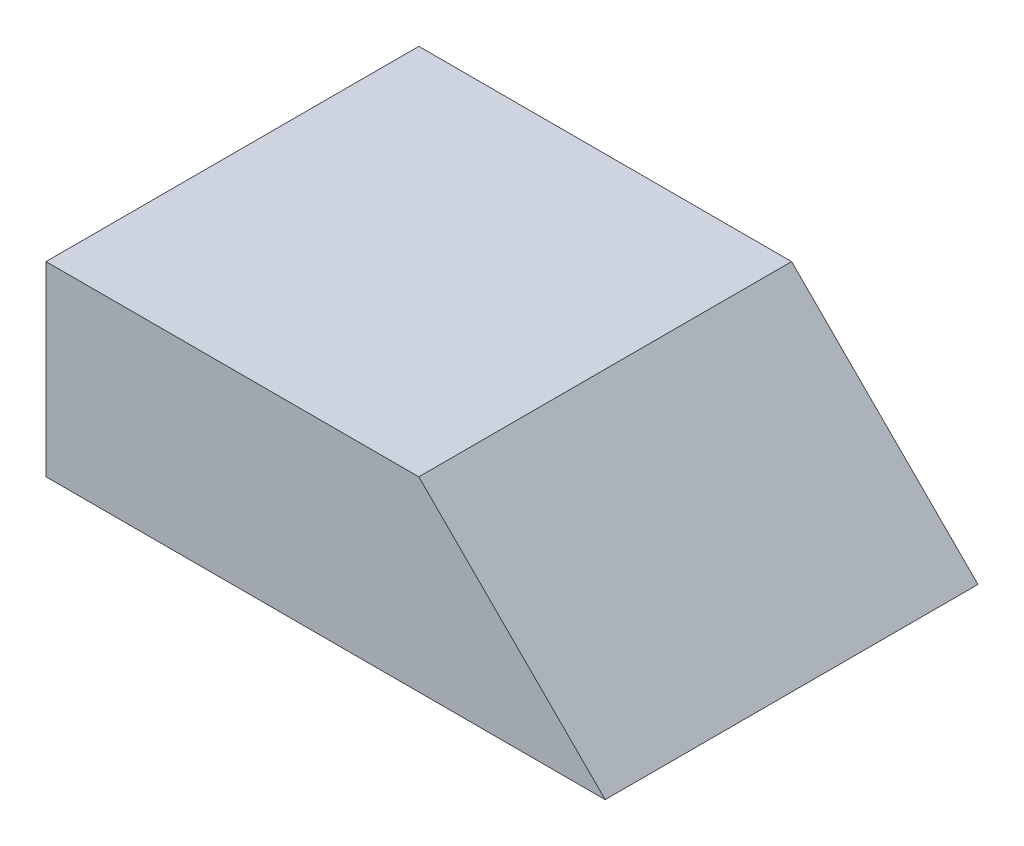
SolidWorks part; units mm, degrees
ref_plane "Front Plane" through (0, 0, 0) normal (0, 0, 1) x (1, 0, 0)
ref_plane "Top Plane" through (0, 0, 0) normal (0, 1, 0) x (1, 0, 0)
ref_plane "Right Plane" through (0, 0, 0) normal (1, 0, 0) x (0, 0, -1)
sketch "Sketch1" plane through (0, 0, 0) normal (0, 0, 1) x (1, 0, 0)
  line L0 (-1, 1) -> (0, 0)
  line L1 (-3, 0) -> (0, 0)
  line L2 (-3, 0) -> (-3, 1)
  line L3 (-3, 1) -> (-1, 1)
  line L5 (-3, 0) -> (0, 0) construction
  line L6 (-3, 1) -> (0, 0) construction
  point P0 (0, 0)
  dimension "D1" = 2
  dimension "D2" = 3
  dimension "D3" = 1
  dimension "D4" = 1
extrude "Boss-Extrude1" add sketch "Sketch1" along normal blind 2
